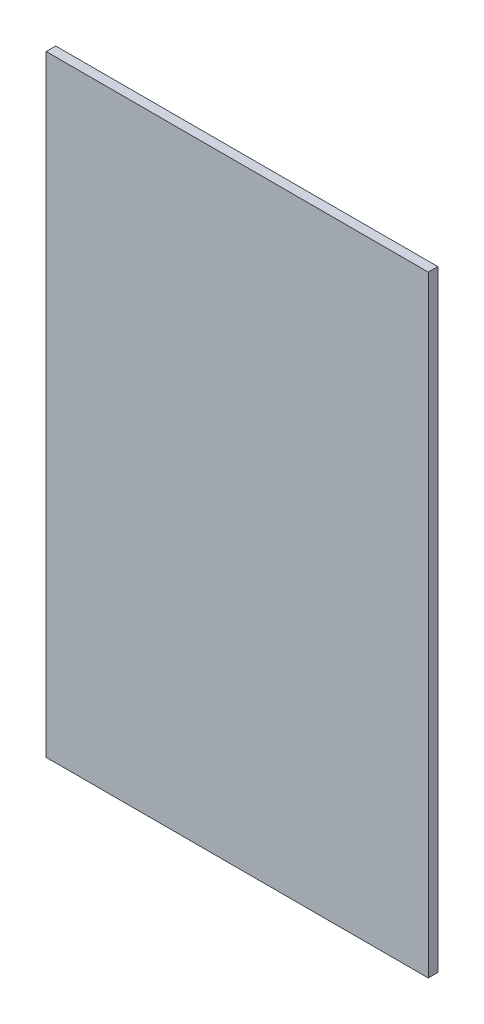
SolidWorks part; units mm, degrees
ref_plane "Front Plane" through (0, 0, 0) normal (0, 0, 1) x (1, 0, 0)
ref_plane "Top Plane" through (0, 0, 0) normal (0, 1, 0) x (1, 0, 0)
ref_plane "Right Plane" through (0, 0, 0) normal (1, 0, 0) x (0, 0, -1)
sketch "Sketch1" plane through (0, 0, 0) normal (0, 0, 1) x (1, 0, 0)
  line L1 (0, 0) -> (254, 0)
  line L2 (0, 0) -> (0, 406.4)
  line L3 (0, 406.4) -> (254, 406.4)
  line L4 (254, 0) -> (254, 406.4)
  dimension "D1" = 254
  dimension "D2" = 406.4
extrude "Boss-Extrude1" add sketch "Sketch1" along normal blind 6.35
